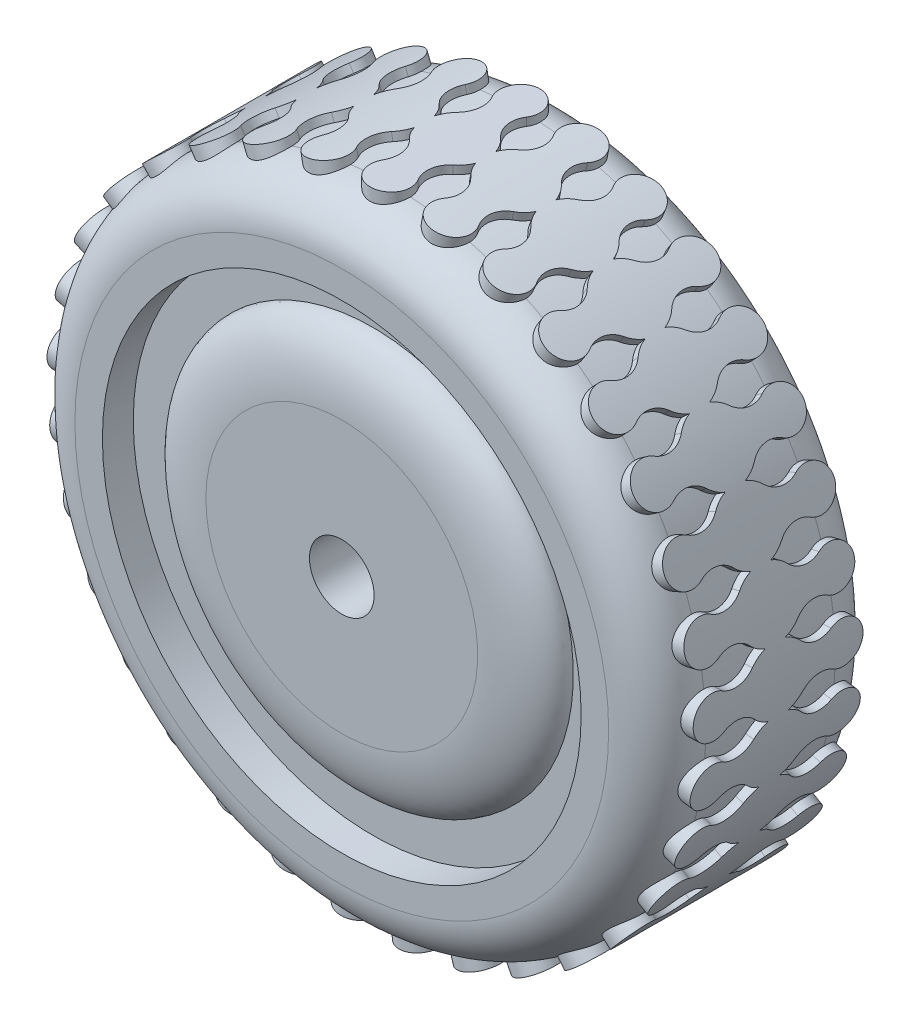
SolidWorks part; units mm, degrees
ref_plane "Front Plane" through (0, 0, 0) normal (0, 0, 1) x (1, 0, 0)
ref_plane "Top Plane" through (0, 0, 0) normal (0, 1, 0) x (1, 0, 0)
ref_plane "Right Plane" through (0, 0, 0) normal (1, 0, 0) x (0, 0, -1)
sketch "Sketch1" plane through (0, 0, 0) normal (0, 0, 1) x (1, 0, 0)
  circle A0 centre (0, 0) radius 19.5
  circle A1 centre (0, 0) radius 2
  dimension "D1" = 4
  dimension "D2" = 39
extrude "Boss-Extrude1" add sketch "Sketch1" along normal blind 14
sketch "Sketch2" plane through (0, 0, 0) normal (0, 0, -1) x (-1, 0, 0)
  circle A0 centre (0, 0) radius 3
  circle A1 centre (0, 0) radius 16
  dimension "D1" = 6
  dimension "D2" = 32
extrude "Cut-Extrude1" cut sketch "Sketch2" against normal blind 8
sketch "Sketch3" plane through (0, 0, 8) normal (0, 0, -1) x (-1, 0, 0)
  circle A0 centre (0, 0) radius 3
  circle A1 centre (0, 0) radius 15
  circle A2 centre (0, 0) radius 16 construction
  dimension "D1" = 1
  dimension "D2" = 6
extrude "Cut-Extrude2" cut sketch "Sketch3" against normal blind 3
sketch "Sketch4" plane through (0, 0, 0) normal (1, 0, 0) x (0, 0, -1)
  line L0 (-14, 14.7999) -> (-12.091, 14.7999)
  line L1 (-14, 19.5) -> (-14, -19.5) construction
  line L2 (-12.091, 14.7999) -> (-12.091, 12.4075)
  line L3 (-14, 8.4015) -> (-14, 14.7999)
  line L4 (0, 0) -> (-14, 0) construction
  line L5 (-29.8954, 2.8376) -> (-29.6581, 2.567) construction
  ellipse E0 centre (-12.091, 8.4015) end of major axis (-12.091, 12.4075) minor radius 1.909 (-12.091, 12.4075) -> (-14, 8.4015) ccw
revolve "Cut-Revolve1" cut sketch "Sketch4" angle 360 about L4
fillet "Fillet1" radius 3 2 edges at (19.5, 0, 0) (19.5, 0, 14)
ref_plane "Plane1" through (0, 20, 0) normal (0, 1, 0) x (1, 0, 0)
sketch "Sketch5" plane through (0, 20, 0) normal (0, 1, 0) x (1, 0, 0)
  line L0 (0, 0) -> (0, -14) construction
  line L1 (-16.5, -14) -> (16.5, -14) construction
  line L2 (19.5, -3) -> (-19.5, -3) construction
  line L3 (19.5, -11) -> (-19.5, -11) construction
  line L4 (-19.5, -7) -> (19.5, -7) construction
  line L5 (-19.5, -3) -> (-19.5, -11) construction
  line L6 (19.5, -11) -> (19.5, -3) construction
  arc A0 (1.0721, -3.6428) -> (-1.0721, -3.6428) centre (0, -3) ccw
  arc A1 (-1.0721, -10.3572) -> (1.0721, -10.3572) centre (0, -11) ccw
  arc A2 (-1.3478, -5.5223) -> (-1.3478, -8.4777) centre (0, -7) ccw
  arc A3 (1.0721, -3.6428) -> (1.3478, -5.5223) centre (2.3586, -4.4141) ccw
  arc A4 (-1.0721, -3.6428) -> (-1.3478, -5.5223) centre (-2.3586, -4.4141) cw
  arc A5 (-1.0721, -10.3572) -> (-1.3478, -8.4777) centre (-2.3586, -9.5859) ccw
  arc A6 (1.0721, -10.3572) -> (1.3478, -8.4777) centre (2.3586, -9.5859) cw
  arc A7 (1.3478, -8.4777) -> (1.3478, -5.5223) centre (0, -7) ccw
  dimension "D1" = 4
  dimension "D2" = 2.5
  dimension "D3" = 3
extrude "Boss-Extrude3" add sketch "Sketch5" against normal blind 3
pattern_circular "CirPattern1" count 33 over 360 about axis through (0, 0, 0) along (0, 0, 1) of "Boss-Extrude3"
sketch "Sketch6" plane through (0, 0, 0) normal (0, 0, 1) x (1, 0, 0)
  circle A0 centre (0, 0) radius 27.0911
  circle A1 centre (0, 0) radius 20
  dimension "D1" = 40
extrude "Cut-Extrude3" cut sketch "Sketch6" along normal blind 23
